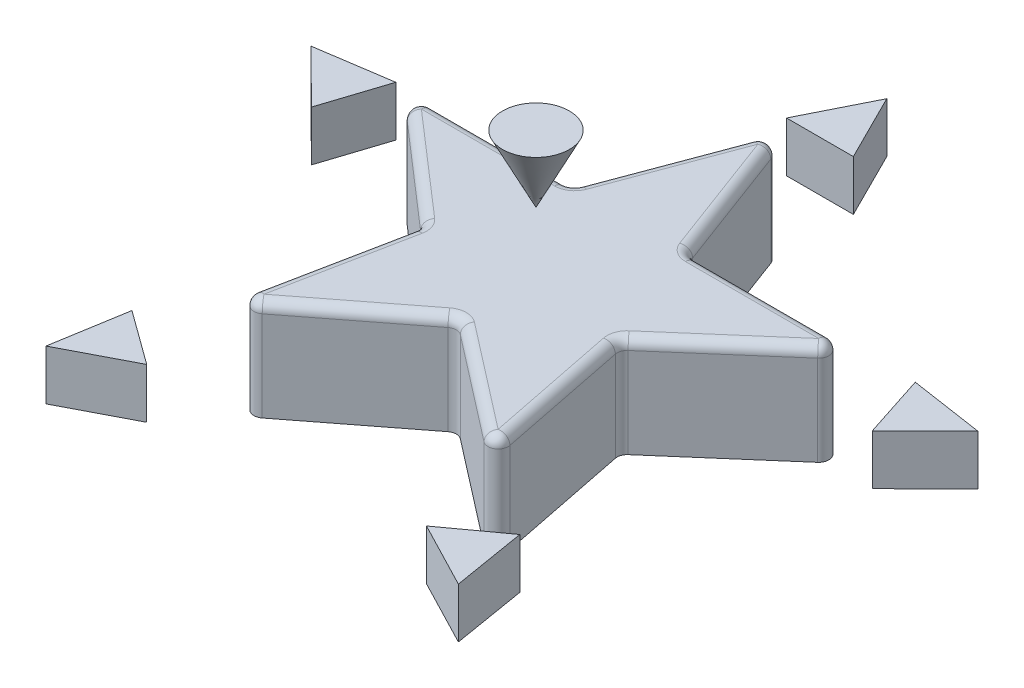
SolidWorks part; units mm, degrees
ref_plane "Front Plane" through (0, 0, 0) normal (0, 0, 1) x (1, 0, 0)
ref_plane "Top Plane" through (0, 0, 0) normal (0, 1, 0) x (1, 0, 0)
ref_plane "Right Plane" through (0, 0, 0) normal (1, 0, 0) x (0, 0, -1)
sketch "Sketch1" plane through (0, 0, 0) normal (0, 1, 0) x (1, 0, 0)
  line L0 (0, 0) -> (0, 75) construction
  line L1 (0, 75) -> (-17.5, 28.1625)
  line L2 (-17.5, 28.1625) -> (-67.5, 28.1625)
  line L3 (-67.5, 28.1625) -> (-29.75, -4.6237)
  line L4 (-29.75, -4.6237) -> (-39.5482, -53.6543)
  line L5 (-39.5482, -53.6543) -> (0, -23.0611)
  line L6 (0, -23.0611) -> (39.5482, -53.6543)
  line L7 (39.5482, -53.6543) -> (29.75, -4.6237)
  line L8 (29.75, -4.6237) -> (67.5, 28.1625)
  line L9 (67.5, 28.1625) -> (17.5, 28.1625)
  line L10 (17.5, 28.1625) -> (0, 75)
  line L11 (-17.5, 28.1625) -> (17.5, 28.1625) construction
  line L12 (29.75, -4.6237) -> (17.5, 28.1625) construction
  line L13 (29.75, -4.6237) -> (0, -23.0611) construction
  line L14 (0, -23.0611) -> (-29.75, -4.6237) construction
  line L15 (-29.75, -4.6237) -> (-17.5, 28.1625) construction
  dimension "D1" = 35
  dimension "D2" = 50
  dimension "D3" = 75
extrude "StarBody" add sketch "Sketch1" along normal mid plane 30
sketch "Sketch2" [suppressed] plane through (0, 0, 0) normal (0, 1, 0) x (1, 0, 0)
  line L0 (0, 92) -> (0, 0) construction
  line L1 (-10, 112.004) -> (10, 112.004)
  line L2 (10, 112.004) -> (0, 92)
  line L3 (0, 92) -> (-10, 112.004)
  line L4 (-10, -60) -> (10, -60)
  line L5 (10, -60) -> (0, -80)
  line L6 (0, -80) -> (-10, -60)
  line L7 (0, 0) -> (0, -60) construction
  dimension "D1" = 20
  dimension "D2" = 20
  dimension "D3" = 20.004
  dimension "D4" = 20
  dimension "D5" = 92
  dimension "D6" = 60
extrude "Boss-Extrude2" [suppressed] add sketch "Sketch2" along normal mid plane 20 separate body
sketch "Sketch4" [suppressed] plane through (0, 15, 0) normal (0, 1, 0) x (1, 0, 0)
  circle A0 centre (71.3408, 35.0973) radius 13.7956
  circle A1 centre (-64.8245, 35.0973) radius 12.2807
  circle A2 centre (-47.5884, -49.7905) radius 14.1232
  circle A3 centre (45.0557, -61.8558) radius 14.6839
  circle A4 centre (22.2178, 35.0973) radius 11.1224
  circle A5 centre (-33.4653, -6.0539) radius 6.4969
extrude "Cut-Extrude1" [suppressed] cut sketch "Sketch4" against normal blind 10 draft 10
sketch "Sketch3" plane through (0, 0, 0) normal (1, 0, 0) x (0, 0, -1)
  line L0 (0, 31.8378) -> (-10, 51.8378) construction
  line L1 (-10, 51.8378) -> (10, 51.8378) construction
  line L3 (10, 51.8378) -> (0, 31.8378)
  line L4 (0, 0) -> (0, 31.8378) construction
  line L5 (0, 31.8378) -> (0, 51.8378)
  line L6 (0, 51.8378) -> (10, 51.8378)
  dimension "D1" = 20
  dimension "D2" = 20
revolve "Revolve1" add sketch "Sketch3" angle 360 about L5
fillet "Fillet1" radius 3 20 edges at (42.5, 15, -28.1625) (48.625, 15, -11.7694) (34.6491, 15, 29.139) (19.7741, 15, 38.3577) (-19.7741, 15, 38.3577) (-34.6491, 15, 29.139) (-48.625, 15, -11.7694) (-42.5, 15, -28.1625) (-8.75, 15, -51.5813) (8.75, 15, -51.5813) (17.5, 0, -28.1625) (67.5, 0, -28.1625) (29.75, 0, 4.6237) (39.5482, 0, 53.6543) (0, 0, 23.0611) (-29.75, 0, 4.6237) (-67.5, 0, -28.1625) (-17.5, 0, -28.1625) (0, 0, -75) (-39.5482, 0, 53.6543)
sketch "Sketch5" plane through (0, 0, 0) normal (0, 1, 0) x (1, 0, 0)
  line L12 (10, 85) -> (-10, 85)
  line L13 (-10, 85) -> (0, 105)
  line L14 (0, 105) -> (10, 85)
  line L15 (0, 0) -> (0, 85) construction
  dimension "D1" = 20
  dimension "D2" = 20
  dimension "D3" = 85
extrude "Boss-Extrude4" add sketch "Sketch5" along normal mid plane 15 separate body
pattern_circular "CirPattern1" count 5 over 360 about axis through (0, 0, 0) along (0, 1, 0)
